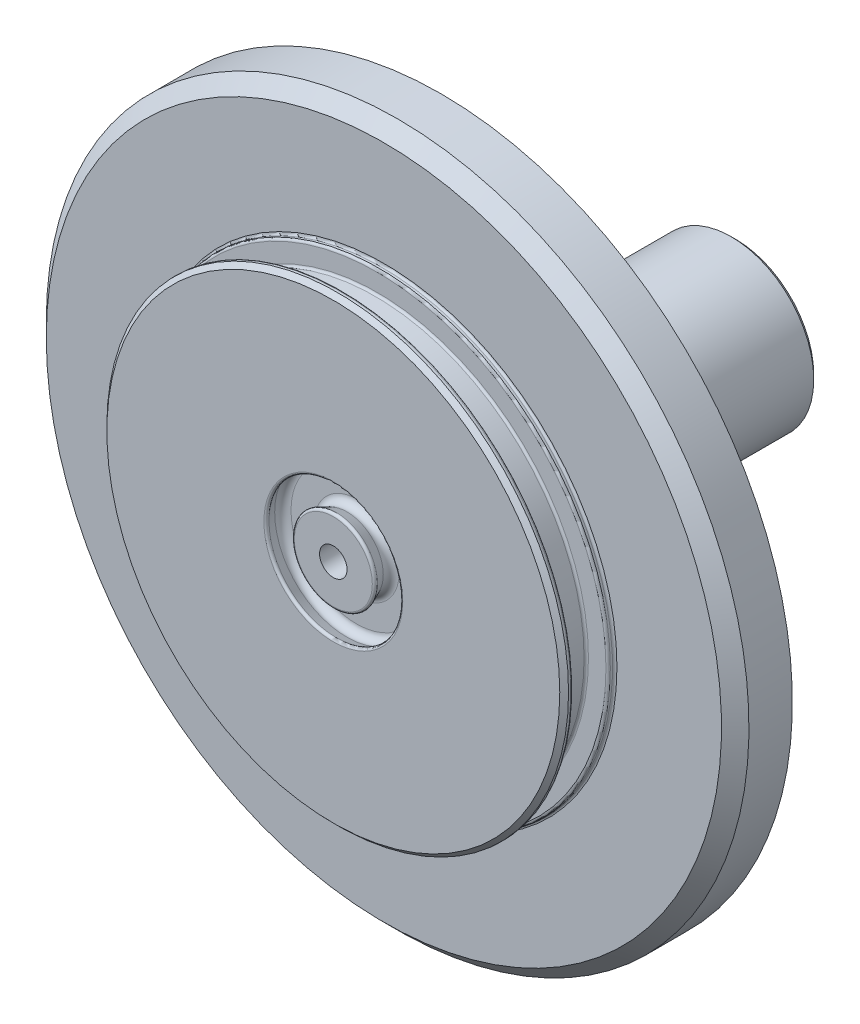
SolidWorks part; units mm, degrees
ref_plane "Front Plane" through (0, 0, 0) normal (0, 0, 1) x (1, 0, 0)
ref_plane "Top Plane" through (0, 0, 0) normal (0, 1, 0) x (1, 0, 0)
ref_plane "Right Plane" through (0, 0, 0) normal (1, 0, 0) x (0, 0, -1)
sketch "Sketch1" plane through (0, 0, 0) normal (0, 0, 1) x (1, 0, 0)
  circle A0 centre (0, 0) radius 13.335
  dimension "D1" = 26.67
extrude "Extrude1" add sketch "Sketch1" along normal mid plane 2.921
sketch "Sketch4" plane through (0, 0, 0) normal (1, 0, 0) x (0, 0, -1)
  line L0 (0, 0) -> (-4.9789, 0) construction
  line L1 (-1.4605, 2.4479) -> (-0.1144, 2.4479) construction
  line L2 (-1.4605, 3.8161) -> (-1.4605, 2.4479)
  line L3 (-1.4605, 2.4479) -> (-0.6717, 2.0967)
  line L4 (-0.1143, 3.1242) -> (-4.7336, 3.1242) construction
  line L5 (-0.686, 4.1609) -> (-1.4605, 3.8161)
  line L6 (-0.1143, 2.4587) -> (-0.1143, 3.7897)
  line L7 (-0.5105, 2.0625) -> (-0.5105, 2.4479) construction
  line L10 (-1.4605, 13.335) -> (-1.4605, -13.335) construction
  arc A0 (-0.6717, 2.0967) -> (-0.1143, 2.4587) centre (-0.5105, 2.4587) ccw
  arc A1 (-0.686, 4.1609) -> (-0.1143, 3.7897) centre (-0.5207, 3.7897) cw
  dimension "D3" = 0.3962
  dimension "D5" = 0.4064
  dimension "D2" = 3.1242
  dimension "D9" = 2.1336
  dimension "D7" = 4.1961
  dimension "D1" = 1.3462
  dimension "D4" = 66
  dimension "D6" = 66
  dimension "D8" = 0.3855
revolve "O-RING GROOVE" cut sketch "Sketch4" angle 360 about L0
sketch "Sketch26" plane through (0, 0, -1.4605) normal (0, 0, -1) x (-1, 0, 0)
  circle A0 centre (0, 0) radius 20.2946
  dimension "D1" = 40.5892
extrude "Extrude3" add sketch "Sketch26" along normal blind 1.27
sketch "Sketch5" plane through (0, 0, -2.7305) normal (0, 0, -1) x (-1, 0, 0)
  circle A0 centre (0, 0) radius 4.7625
  dimension "D1" = 9.525
extrude "Extrude2" add sketch "Sketch5" along normal blind 19.05
hole_wizard ".25-28 middle" positions "Sketch22" profile "Sketch23" legacy
sketch "Sketch22" plane through (13.9719, -66.055, -21.7805) normal (0, 0, -1) x (-1, 0, 0)
  point P0 (13.9719, 66.055)
sketch "Sketch23" plane through (0, 0, -21.7805) normal (1, 0, 0) x (0, 1, 0)
  line L0 (0, 0) -> (0, 7.9375)
  line L1 (0, 7.9375) -> (2.7051, 7.9375)
  line L2 (2.7051, 7.9375) -> (2.7051, 7.0307)
  line L3 (2.7051, 7.0307) -> (3.175, 7.0307)
  line L4 (3.175, 7.0307) -> (3.175, 0.6132)
  line L5 (3.175, 0.6132) -> (3.429, 0)
  line L6 (3.429, 0) -> (0, 0)
hole_wizard "Hole1" positions "Sketch25" profile "Sketch24" hole size "1/16" standard "Ansi Inch"
sketch "Sketch25" plane through (0.051, 13.0934, -13.843) normal (0, 0, -1) x (-1, 0, 0)
  point P0 (0.051, -13.0934)
sketch "Sketch24" plane through (0, 0, -13.843) normal (1, 0, 0) x (0, 1, 0)
  line L0 (0, 0) -> (0, 15.3035)
  line L1 (0, 15.3035) -> (0.7937, 15.3035)
  line L2 (0.7937, 15.3035) -> (0.7937, 0)
  line L5 (0.7937, 0) -> (0, 0)
  line L11 (0, -6.35) -> (0, 107.95) construction
  dimension "Thru Hole Dia." = 1.5875
  dimension "Thru Hole Depth" = 15.3035
other "Flat Bottom-.25-28<1>"
sketch "Sketch27" plane through (0, 0, -2.7305) normal (0, 0, -1) x (-1, 0, 0)
  circle A0 centre (0, 0) radius 20.2946 construction
  circle A1 centre (0, 0) radius 20.2946
  circle A2 centre (0, 0) radius 15.3035
  dimension "D1" = 30.607
extrude "Pocket" add sketch "Sketch27" along normal blind 2.032
sketch "Sketch28" plane through (0, 0, 0) normal (1, 0, 0) x (0, 0, -1)
  line L0 (0, 0) -> (18.2124, 0) construction
  line L1 (21.7805, 0) -> (2.7305, 0) construction
  line L2 (-1.4605, 0) -> (1.4605, 0) construction
  line L3 (21.7805, -4.7625) -> (21.7805, 4.7625) construction
  line L4 (9.5885, 5.6515) -> (10.6045, 5.6515)
  line L5 (9.5885, 5.6515) -> (9.5885, 4.1275)
  line L6 (9.5885, 4.1275) -> (10.6045, 4.1275)
  line L7 (10.6045, 5.6515) -> (10.6045, 4.1275)
  dimension "D1" = 1.016
  dimension "D2" = 8.255
  dimension "D3" = 11.176
  dimension "D4" = 1.524
revolve "Cut-Revolve1" cut sketch "Sketch28" angle 360 about L0
chamfer "Chamfer1" distance 0.254 angle 45 1 edges at (-4.7625, 0, -21.7805)
chamfer "Chamfer3" distance 0.7937 angle 45 1 edges at (-20.2946, 0, -1.4605)
fillet "Fillet1" radius 0.127 1 edges at (-3.8161, 0, 1.4605)
fillet "Fillet2" radius 0.127 1 edges at (-2.4479, 0, 1.4605)
sketch "Sketch29" plane through (0, 0, 0) normal (1, 0, 0) x (0, 0, -1)
  line L0 (1.4605, 13.335) -> (-1.4605, 13.335) construction
  line L1 (-0.9525, 13.335) -> (1.0795, 13.335)
  line L2 (-0.9525, 13.335) -> (-0.9525, 12.0713)
  line L3 (-0.9525, 12.0713) -> (1.0795, 12.0713)
  line L4 (1.0795, 13.335) -> (1.0795, 12.0713)
  line L6 (0, 0) -> (4.7625, 0) construction
  line L7 (4.7625, -20.2946) -> (4.7625, 20.2946) construction
  line L8 (1.4605, 13.335) -> (1.4605, -13.335) construction
  dimension "D1" = 2.032
  dimension "D2" = 12.0713
  dimension "D3" = 0.381
revolve "Cut-Revolve2" cut sketch "Sketch29" angle 360 about L6
chamfer "Chamfer4" distance 0.254 angle 45 1 edges at (13.335, 0, 1.4605)
fillet "Fillet3" radius 0.127 5 edges at (12.0713, 0, -1.0795) (12.0713, 0, 0.9525) (13.335, 0, -1.0795) (13.335, 0, 0.9525) (-13.335, 0, -1.4605)
